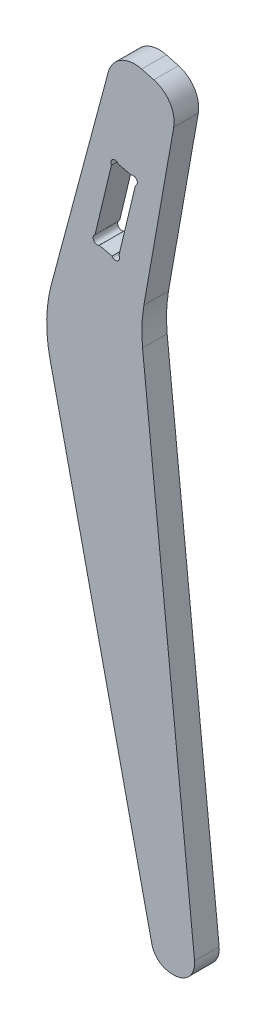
SolidWorks part; units mm, degrees
ref_plane "Plan de face" through (0, 0, 0) normal (0, 0, 1) x (1, 0, 0)
ref_plane "Plan de dessus" through (0, 0, 0) normal (0, 1, 0) x (1, 0, 0)
ref_plane "Plan de droite" through (0, 0, 0) normal (1, 0, 0) x (0, 0, -1)
sketch "Esquisse1" plane through (0, 0, 0) normal (0, 0, 1) x (1, 0, 0)
  line L9 (189.331, 95.7653) -> (141.3697, -83.2289)
  line L16 (216.5293, -87.0369) -> (243.6209, -349.9519)
  line L17 (144.4752, -97.1274) -> (202.3992, -356.3601)
  line L18 (192.6555, 42.157) -> (210.1605, 37.9647)
  line L25 (216.8638, -30.5204) -> (237.1885, 84.7465)
  line L28 (169.5591, 21.9753) -> (189.331, 95.7653)
  line L36 (237.1885, 84.7465) -> (212.977, -52.5635)
  line L37 (167.232, 31.7556) -> (225.1102, 16.2472) construction
  line L38 (217.9111, 108.9699) -> (168.2375, -98.4426) construction
  line L39 (192.6555, 42.157) -> (194.7185, 41.663)
  line L40 (178.6812, -16.1929) -> (196.1861, -20.3852)
  line L41 (192.6555, 42.157) -> (178.6812, -16.1929)
  line L42 (210.1605, 37.9647) -> (196.1861, -20.3852)
  line L43 (194.2244, 39.6) -> (192.1614, 40.0941) construction
  line L44 (192.1614, 40.0941) -> (194.2244, 39.6) construction
  line L45 (194.2244, 39.6) -> (194.7185, 41.663) construction
  line L46 (196.7815, 41.1689) -> (210.1605, 37.9647)
  line L47 (194.7185, 41.663) -> (196.7815, 41.1689)
  line L52 (213.8259, 109.9074) -> (227.0984, 106.3511) construction
  line L53 (171.809, 30.3721) -> (225.0838, 16.0972) construction
  line L54 (227.0984, 106.3511) -> (177.4248, -101.0615) construction
  line L55 (192.6555, 42.157) -> (194.7185, 41.663)
  line L56 (178.6812, -16.1929) -> (196.1861, -20.3852)
  line L57 (192.6555, 42.157) -> (178.6812, -16.1929)
  line L58 (210.1605, 37.9647) -> (196.1861, -20.3852)
  line L59 (194.2244, 39.6) -> (192.1614, 40.0941) construction
  line L60 (192.1614, 40.0941) -> (194.2244, 39.6) construction
  line L61 (194.2244, 39.6) -> (194.7185, 41.663) construction
  line L62 (196.7815, 41.1689) -> (210.1605, 37.9647)
  line L63 (194.7185, 41.663) -> (196.7815, 41.1689)
  line L65 (213.8259, 109.9074) -> (222.6687, 107.538)
  line L66 (202.3992, -356.3601) -> (141.3697, -83.2289)
  line L67 (243.6209, -349.9519) -> (212.977, -52.5635)
  line L68 (223.7979, -452.1276) -> (202.3992, -356.3601)
  line L69 (254.1494, -452.1276) -> (223.7979, -452.1276)
  line L71 (243.6209, -349.9519) -> (254.1494, -452.1276)
  arc A27 (222.6687, 107.538) -> (237.1885, 84.7465) centre (217.4923, 88.2195) cw
  arc A28 (213.8259, 109.9074) -> (189.331, 95.7653) centre (208.6496, 90.5889) ccw
  point P6 (245.8918, -371.9909)
  point P9 (205.8918, -371.9909)
  point P14 (201.408, 40.0609)
  point P52 (210.6108, 37.5068)
  point P71 (201.408, 40.0609)
  dimension "D9" = 18
  dimension "D12" = 20
  dimension "D14" = 18
  dimension "D4" = 259.2327
  dimension "D2" = 40
  dimension "D8" = 60
  dimension "D13" = 60
extrude "Boss.-Extru.2" add sketch "Esquisse1" along normal blind 18
fillet "Congé1" radius 100 2 edges at (141.3697, -83.2289, 9) (212.977, -52.5635, 9)
sketch "Esquisse3" plane through (0, 0, 18) normal (0, 0, 1) x (1, 0, 0)
  line L0 (194.2244, 39.6) -> (192.1614, 40.0941) construction
  line L1 (192.6555, 42.157) -> (178.6812, -16.1929) construction
  line L2 (194.2244, 39.6) -> (194.7185, 41.663) construction
  line L3 (192.6555, 42.157) -> (210.1605, 37.9647) construction
  line L4 (201.408, 40.0609) -> (187.4336, -18.2891) construction
  line L5 (178.6812, -16.1929) -> (196.1861, -20.3852) construction
  line L6 (185.6683, 12.9821) -> (203.1733, 8.7898) construction
  line L7 (210.1605, 37.9647) -> (196.1861, -20.3852) construction
  circle A0 centre (194.2244, 39.6) radius 3
  circle A1 centre (194.6172, -17.8282) radius 3
  circle A2 centre (207.6034, 36.3958) radius 3
  circle A3 centre (181.2382, -14.624) radius 3
  point P17 (194.4208, 10.8859)
  point P22 (194.4208, 10.8859)
  dimension "D1" = 6
  dimension "D2" = 2
extrude "Enlèv. mat.-Extru.1" cut sketch "Esquisse3" against normal blind 18
fillet "Congé3" radius 15 2 edges at (254.1494, -452.1276, 9) (223.7979, -452.1276, 9)
